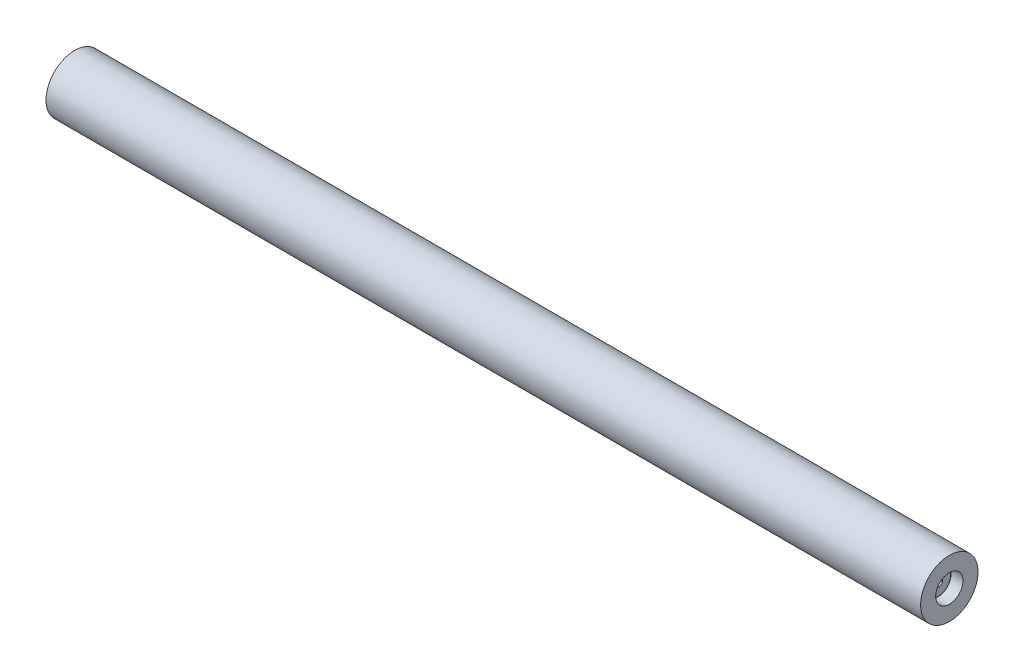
SolidWorks part; units mm, degrees
ref_plane "Front Plane" through (0, 0, 0) normal (0, 0, 1) x (1, 0, 0)
ref_plane "Top Plane" through (0, 0, 0) normal (0, 1, 0) x (1, 0, 0)
ref_plane "Right Plane" through (0, 0, 0) normal (1, 0, 0) x (0, 0, -1)
sketch "Sketch1" plane through (0, 0, 0) normal (0, 0, 1) x (1, 0, 0)
  line L0 (0, 0) -> (0, 12.5095)
  line L1 (0, 12.5095) -> (381, 12.5095)
  line L2 (381, 12.5095) -> (381, 0)
  line L3 (381, 0) -> (0, 0)
  line L4 (381, 0) -> (0, 0) construction
revolve "Revolve1" add sketch "Sketch1" angle 360 about L4
ref_plane "Plane1" through (355.6, 0, 0) normal (1, 0, 0) x (0, 0, -1)
sketch "Sketch2" plane through (0, 0, 0) normal (1, 0, 0) x (0, 0, -1)
  circle A0 centre (0, 0) radius 5.9563
ref_plane "Plane2" through (381, 0, 0) normal (1, 0, 0) x (0, 0, -1)
sketch "Sketch3" plane through (381, 0, 0) normal (1, 0, 0) x (0, 0, -1)
  circle A0 centre (0, 0) radius 5.9563
extrude "Cut-Extrude1" cut sketch "Sketch3" against normal blind 9.525
extrude "Cut-Extrude2" cut sketch "Sketch2" along normal blind 9.525
sketch "Sketch4" plane through (0, 0, 0) normal (0, 0, 1) x (1, 0, 0)
  line L0 (4.7625, 0) -> (4.7625, 5.2578)
  line L1 (5.2705, 5.7658) -> (9.525, 5.7658)
  line L2 (9.525, 5.7658) -> (9.525, 0)
  line L3 (9.525, 0) -> (4.7625, 0)
  line L4 (9.525, 0) -> (4.7625, 0) construction
  arc A0 (4.7625, 5.2578) -> (5.2705, 5.7658) centre (5.2705, 5.2578) cw
revolve "Revolve2" add sketch "Sketch4" angle 360 about L4
sketch "Sketch5" plane through (0, 0, 0) normal (0, 0, 1) x (1, 0, 0)
  line L0 (371.475, 0) -> (371.475, 5.7658)
  line L1 (371.475, 5.7658) -> (375.7295, 5.7658)
  line L2 (376.2375, 5.2578) -> (376.2375, 0)
  line L3 (376.2375, 0) -> (371.475, 0)
  line L4 (376.2375, 0) -> (371.475, 0) construction
  arc A0 (375.7295, 5.7658) -> (376.2375, 5.2578) centre (375.7295, 5.2578) cw
revolve "Revolve3" add sketch "Sketch5" angle 360 about L4
ref_plane "Plane3" through (4.7625, 0, 0) normal (1, 0, 0) x (0, 0, -1)
sketch "Sketch6" plane through (4.7625, 0, 0) normal (1, 0, 0) x (0, 0, -1)
  line L0 (-1.8352, 1.0595) -> (-1.8352, -1.0595)
  line L1 (-1.8352, -1.0595) -> (0, -2.119)
  line L2 (0, -2.119) -> (1.8352, -1.0595)
  line L3 (1.8352, -1.0595) -> (1.8352, 1.0595)
  line L4 (1.8352, 1.0595) -> (0, 2.119)
  line L5 (0, 2.119) -> (-1.8352, 1.0595)
ref_plane "Plane4" through (376.2375, 0, 0) normal (1, 0, 0) x (0, 0, -1)
sketch "Sketch7" plane through (376.2375, 0, 0) normal (1, 0, 0) x (0, 0, -1)
  line L0 (-1.8352, 1.0595) -> (-1.8352, -1.0595)
  line L1 (-1.8352, -1.0595) -> (0, -2.119)
  line L2 (0, -2.119) -> (1.8352, -1.0595)
  line L3 (1.8352, -1.0595) -> (1.8352, 1.0595)
  line L4 (1.8352, 1.0595) -> (0, 2.119)
  line L5 (0, 2.119) -> (-1.8352, 1.0595)
extrude "Cut-Extrude3" cut sketch "Sketch7" against normal blind 2.3813
extrude "Cut-Extrude4" cut sketch "Sketch6" along normal blind 2.3813
